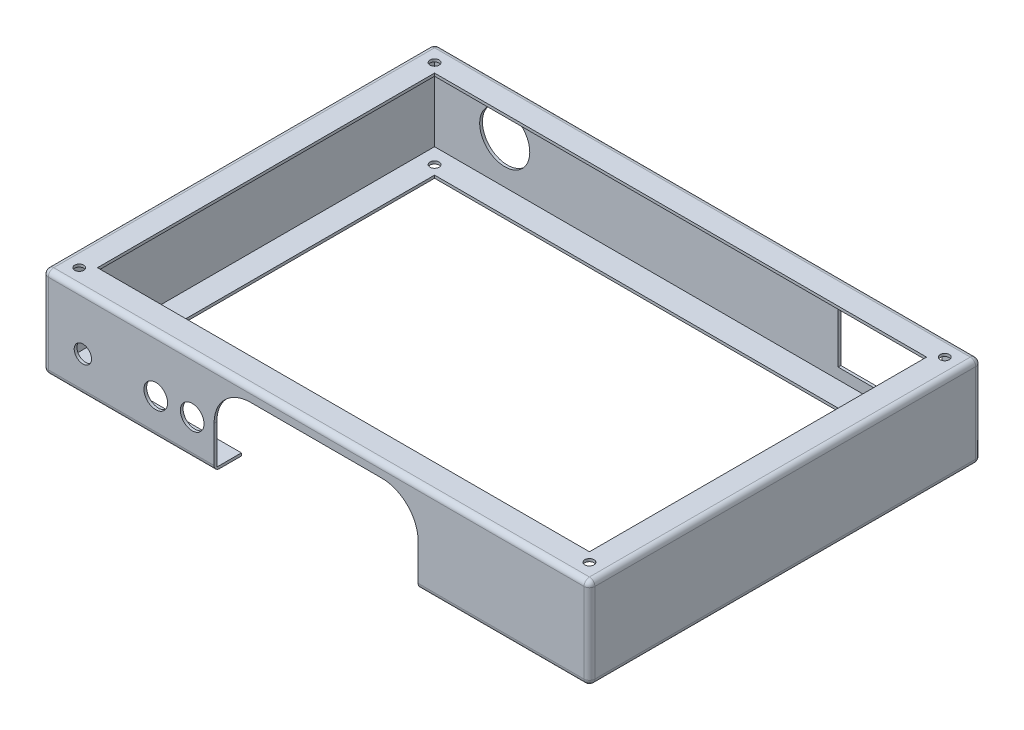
SolidWorks part; units mm, degrees
ref_plane "Plan de face" through (0, 0, 0) normal (0, 0, 1) x (1, 0, 0)
ref_plane "Plan de dessus" through (0, 0, 0) normal (0, 1, 0) x (1, 0, 0)
ref_plane "Plan de droite" through (0, 0, 0) normal (1, 0, 0) x (0, 0, -1)
sketch "Esquisse1" plane through (0, 0, 0) normal (0, 1, 0) x (1, 0, 0)
  line L1 (0, 0) -> (300, 0)
  line L2 (0, 0) -> (0, 215)
  line L3 (0, 215) -> (300, 215)
  line L4 (300, 0) -> (300, 215)
  dimension "D1" = 215
  dimension "D2" = 300
extrude "Boss.-Extru.1" add sketch "Esquisse1" along normal blind 50
shell "Coque1" thickness 1.5
fillet "Congé2" radius 3 12 edges at (150, 50, -215) (300, 50, -107.5) (150, 50, 0) (0, 50, -107.5) (0, 25, 0) (0, 25, -215) (300, 25, 0) (300, 25, -215) (150, 0, 0) (300, 0, -107.5) (150, 0, -215) (0, 0, -107.5)
fillet "Congé3" [suppressed] radius 1.5
sketch "Esquisse2" plane through (0, 0, 0) normal (0, 0, 1) x (1, 0, 0)
  line L1 (150, 50) -> (150, 0) construction
  line L2 (3, 50) -> (297, 50) construction
  line L3 (297, 0) -> (3, 0) construction
  line L4 (0, 3) -> (0, 47) construction
  line L8 (114, 43) -> (186, 43)
  line L9 (94, 23) -> (94, 0)
  line L10 (94, 0) -> (206, 0)
  line L11 (206, 23) -> (206, 0)
  arc A0 (206, 23) -> (186, 43) centre (186, 23) ccw
  arc A1 (94, 23) -> (114, 43) centre (114, 23) cw
  circle A2 centre (82, 20) radius 6.5
  circle A3 centre (22, 20) radius 4.75
  circle A4 centre (62, 20) radius 6.5
  point P14 (206, 43)
  point P17 (94, 43)
  dimension "D4" = 20
  dimension "D5" = 13
  dimension "D6" = 20
  dimension "D7" = 12
  dimension "D8" = 9.5
  dimension "D9" = 60
  dimension "D10" = 13
  dimension "D11" = 20
  dimension "D1" = 150
  dimension "D2" = 112
  dimension "D3" = 43
extrude "Enlèv. mat.-Extru.1" cut sketch "Esquisse2" against normal blind 15
sketch "Esquisse3" plane through (0, 50, 0) normal (0, 1, 0) x (-1, 0, 0)
  line L0 (-3, -215) -> (-297, -215) construction
  line L1 (-15, -200) -> (-285, -200)
  line L2 (-15, -200) -> (-15, -15)
  line L3 (-15, -15) -> (-285, -15)
  line L4 (-285, -200) -> (-285, -15)
  line L5 (0, -3) -> (0, -212) construction
  line L6 (-300, -212) -> (-300, -3) construction
  line L7 (-297, 0) -> (-3, 0) construction
  dimension "D1" = 15
  dimension "D2" = 15
  dimension "D3" = 15
  dimension "D4" = 15
extrude "Enlèv. mat.-Extru.2" cut sketch "Esquisse3" against normal through all both and the other way through all
sketch "Esquisse5" plane through (0, 0, -215) normal (0, 0, -1) x (-1, 0, 0)
  line L0 (0, 47) -> (0, 3) construction
  line L1 (-300, 3) -> (-300, 47) construction
  line L3 (-280, 42.5) -> (-223, 42.5)
  line L4 (-280, 42.5) -> (-280, 7.5)
  line L7 (-41.5, 40) -> (-41.5, 38.6679)
  line L8 (-38.5, 40) -> (-38.5, 38.6679)
  line L9 (-41.5, 40) -> (-38.5, 40)
  line L10 (-280, 7.5) -> (-223, 7.5)
  line L11 (-223, 42.5) -> (-223, 7.5)
  line L12 (-297, 0) -> (-3, 0) construction
  arc A0 (-41.5, 38.6679) -> (-38.5, 38.6679) centre (-40, 25) ccw
  dimension "D5" = 27.5
  dimension "D6" = 57
  dimension "D7" = 40
  dimension "D2" = 25
  dimension "D3" = 35
  dimension "D4" = 7.5
  dimension "D8" = 1.5
  dimension "D9" = 1.5
  dimension "D10" = 15
  dimension "D11" = 20
extrude "Enlèv. mat.-Extru.4" cut sketch "Esquisse5" against normal up to next
sketch "Esquisse6" plane through (0, 50, 0) normal (0, 1, 0) x (1, 0, 0)
  line L0 (3, 215) -> (297, 215) construction
  line L1 (10, 205) -> (290, 205) construction
  line L2 (10, 205) -> (10, 10) construction
  line L3 (10, 10) -> (290, 10) construction
  line L4 (290, 205) -> (290, 10) construction
  line L5 (300, 212) -> (300, 3) construction
  line L6 (0, 3) -> (0, 212) construction
  line L7 (297, 0) -> (3, 0) construction
  circle A0 centre (290, 205) radius 2.5
  circle A1 centre (10, 205) radius 2.5
  circle A2 centre (10, 10) radius 2.5
  circle A3 centre (290, 10) radius 2.5
  dimension "D1" = 10
  dimension "D2" = 10
  dimension "D3" = 10
  dimension "D4" = 10
extrude "Enlèv. mat.-Extru.5" cut sketch "Esquisse6" against normal through all both and the other way through all
